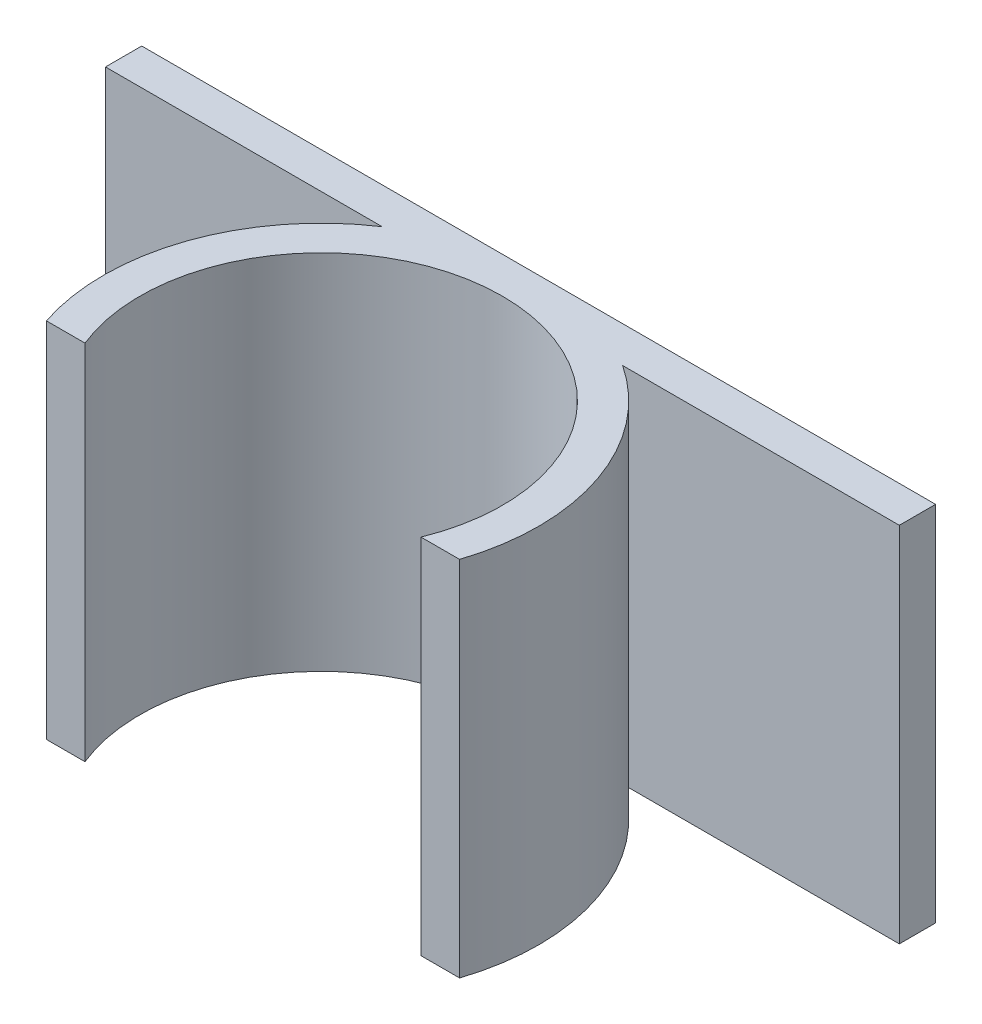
SolidWorks part; units mm, degrees
ref_plane "前视基准面" through (0, 0, 0) normal (0, 0, 1) x (1, 0, 0)
ref_plane "上视基准面" through (0, 0, 0) normal (0, 1, 0) x (1, 0, 0)
ref_plane "右视基准面" through (0, 0, 0) normal (1, 0, 0) x (0, 0, -1)
other "Configuration Table"
sketch "草图1" plane through (0, 0, 0) normal (0, 1, 0) x (1, 0, 0)
  circle A0 centre (0, 0) radius 5
  circle A1 centre (0, 0) radius 6
extrude "凸台-拉伸1" add sketch "草图1" along normal blind 10
sketch "草图2" plane through (0, 0, 0) normal (0, -1, 0) x (1, 0, 0)
  line L0 (0, -5) -> (0, -6)
  line L2 (-10.9483, -6) -> (10.9483, -6)
  line L3 (-10.9483, -6) -> (-10.9483, -5)
  line L4 (-10.9483, -5) -> (10.9483, -5)
  line L5 (10.9483, -6) -> (10.9483, -5)
  line L6 (-10.9483, -6) -> (10.9483, -5) construction
  line L7 (-10.9483, -5) -> (10.9483, -6) construction
  circle A0 centre (0, 0) radius 5 construction
  circle A1 centre (0, 0) radius 6 construction
  point P8 (0, -5.5)
extrude "凸台-拉伸2" add sketch "草图2" against normal blind 10 contours L4 L3 L2 M1 | L2 L5 L4 M1
sketch "草图3" plane through (0, 10, 0) normal (0, 1, 0) x (1, 0, 0)
  line L1 (-7.1398, -6) -> (7.5861, -6)
  line L2 (-7.1398, -6) -> (-7.1398, -2.971)
  line L3 (-7.1398, -2.971) -> (7.5861, -2.971)
  line L4 (7.5861, -6) -> (7.5861, -2.971)
extrude "切除-拉伸1" cut sketch "草图3" against normal blind 10
sketch "草图4" plane through (0, 0, 0) normal (0, -1, 0) x (1, 0, 0)
  line L1 (-7.1633, 2.971) -> (6.952, 2.971)
  line L2 (-7.1633, 2.971) -> (-7.1633, 1.8793)
  line L3 (-7.1633, 1.8793) -> (6.952, 1.8793)
  line L4 (6.952, 2.971) -> (6.952, 1.8793)
extrude "切除-拉伸2" cut sketch "草图4" against normal blind 10
